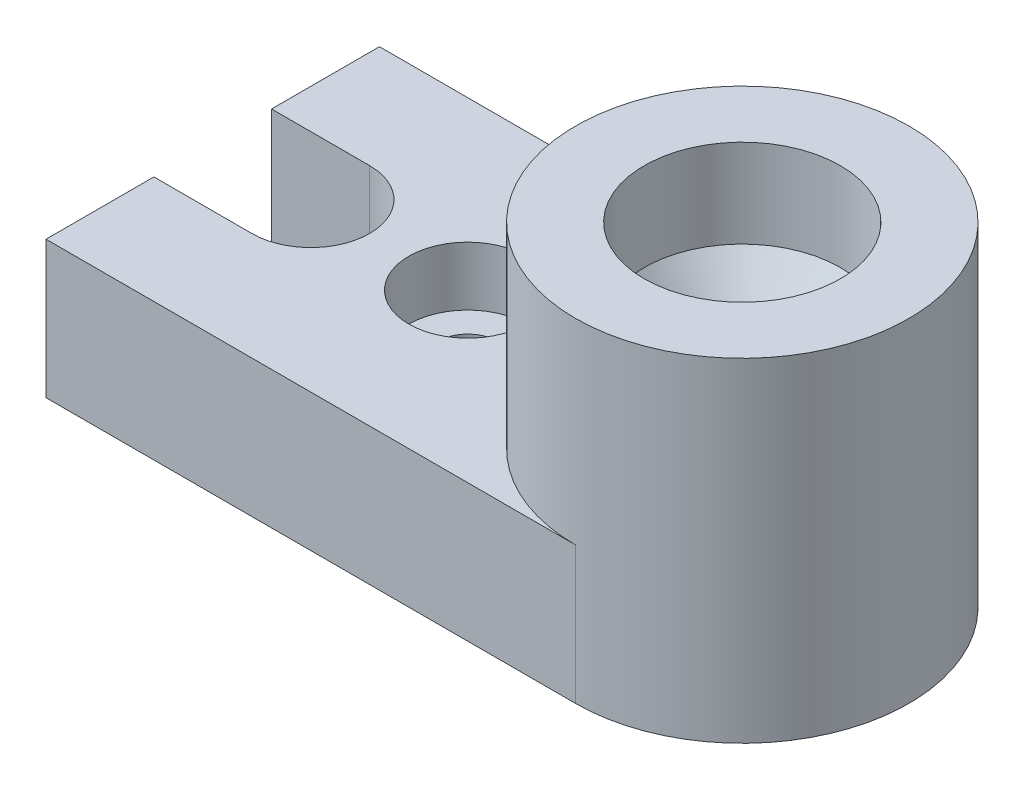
SolidWorks part; units mm, degrees
ref_plane "前视基准面" through (0, 0, 0) normal (0, 0, 1) x (1, 0, 0)
ref_plane "上视基准面" through (0, 0, 0) normal (0, 1, 0) x (1, 0, 0)
ref_plane "右视基准面" through (0, 0, 0) normal (1, 0, 0) x (0, 0, -1)
sketch "草图1" plane through (0, 0, 0) normal (0, 1, 0) x (1, 0, 0)
  line L0 (0, -17) -> (-54, -17)
  line L1 (-54, -17) -> (-54, -6)
  line L2 (-54, 17) -> (0, 17)
  line L3 (-44, 6) -> (-54, 6)
  line L5 (-54, -6) -> (-44, -6)
  line L6 (-54, 6) -> (-54, 17)
  arc A0 (0, -17) -> (0, 17) centre (0, 0) ccw
  arc A1 (-44, -6) -> (-44, 6) centre (-44, 0) ccw
  circle A2 centre (-28, 0) radius 3
extrude "拉伸1" add sketch "草图1" along normal blind 14
sketch "草图2" plane through (0, 14, 0) normal (0, 1, 0) x (1, 0, 0)
  circle A0 centre (0, 0) radius 17
extrude "拉伸2" add sketch "草图2" along normal blind 20
sketch "草图3" plane through (0, 0, 0) normal (0, 0, 1) x (1, 0, 0)
  line L0 (0, 34) -> (0, -9.2486) construction
  line L1 (17, 34) -> (-17, 34) construction
  line L2 (10, 34) -> (10, 25)
  line L3 (10, 25) -> (4.8492, 18)
  line L4 (4.8492, 18) -> (4.8492, 0)
  line L5 (0, 0) -> (17, 0) construction
  line L6 (4.8492, 0) -> (0, 0)
  line L7 (0, 0) -> (0, 34)
  line L8 (0, 34) -> (10, 34)
revolve "切除-旋转1" cut sketch "草图3" angle 360 about L0
sketch "草图4" plane through (0, 14, 0) normal (0, 1, 0) x (1, 0, 0)
  circle A0 centre (-28, 0) radius 6
extrude "切除-拉伸1" cut sketch "草图4" against normal blind 6
